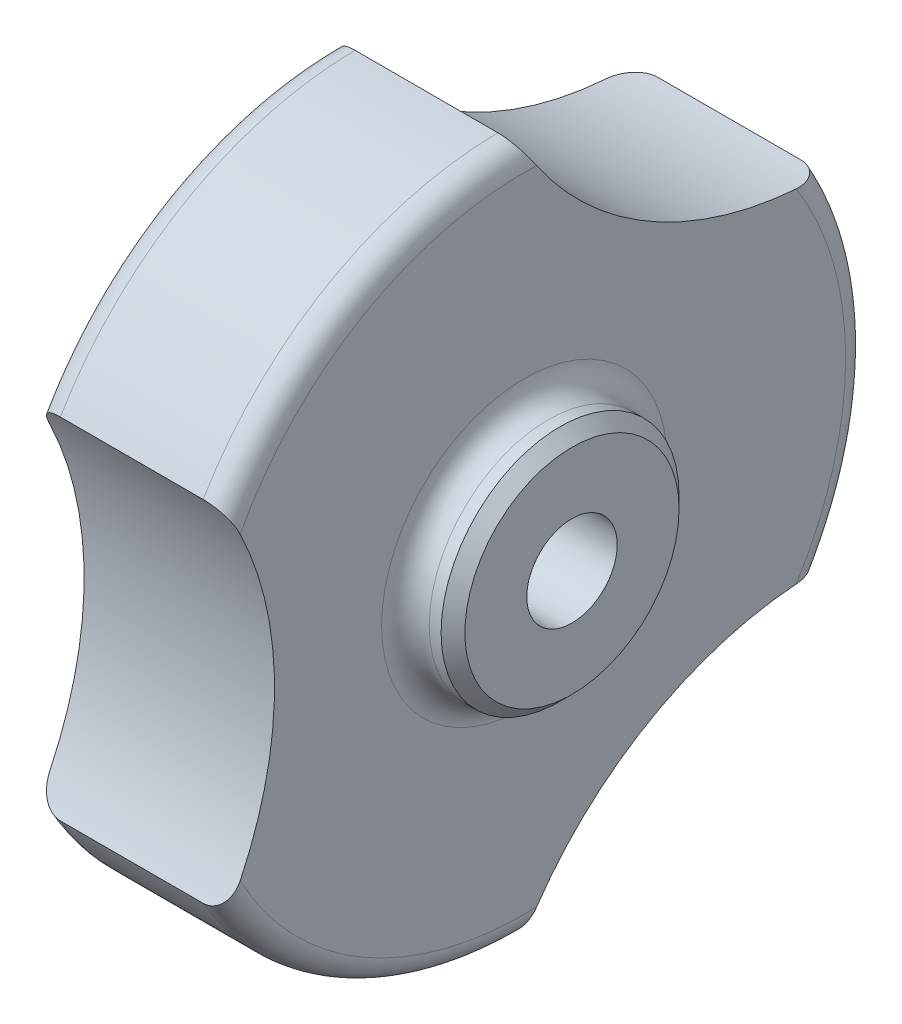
SolidWorks part; units mm, degrees
ref_plane "Plan de face" through (0, 0, 0) normal (0, 0, 1) x (1, 0, 0)
ref_plane "Plan de dessus" through (0, 0, 0) normal (0, 1, 0) x (1, 0, 0)
ref_plane "Plan de droite" through (0, 0, 0) normal (1, 0, 0) x (0, 0, -1)
sketch "Esquisse1" plane through (0, 0, 0) normal (0, 0, 1) x (1, 0, 0)
  line L0 (0, 0) -> (23.0527, 0) construction
  line L1 (0, 0) -> (0, 14.5)
  line L2 (0, 14.5) -> (8, 14.5)
  line L3 (8, 14.5) -> (8, 0)
  line L6 (0, 0) -> (8, 0)
  dimension "D3" = 8
  dimension "D4" = 29
revolve "Révolution1" add sketch "Esquisse1" angle 360 about L0
fillet "Congé1" radius 1 2 edges at (8, 0, 14.5) (0, 0, 14.5)
sketch "Esquisse2" plane through (0, 0, 0) normal (-1, 0, 0) x (0, 0, 1)
  line L0 (0, 0) -> (25, 0) construction
  circle A0 centre (25, 0) radius 14.5
  dimension "D1" = 29
  dimension "D2" = 25
extrude "Enlèv. mat.-Extru.1" cut sketch "Esquisse2" against normal through all
pattern_circular "Répétition circulaire1" count 3 over 360 about axis through (0, 0, 0) along (1, 0, 0) of "Enlèv. mat.-Extru.1"
hole_wizard "Diamètre du perçage Ø3.8 (3.8)1" positions "Esquisse4" profile "Esquisse3" hole size "Ø3.8" standard "ISO"
sketch "Esquisse4" plane through (8, 0, 0) normal (1, 0, 0) x (0, 0, -1)
  arc A0 (0.5143, 13.4902) -> (-11.94, 6.2997) centre (0, 0) ccw construction
  point P0 (0, 0)
sketch "Esquisse3" plane through (8, 0, 0) normal (0, 1, 0) x (0, 0, -1)
  line L0 (0, 0) -> (0, 7.6416)
  line L1 (0, 7.6416) -> (1.9, 6.5)
  line L2 (1.9, 6.5) -> (1.9, 0)
  line L5 (1.9, 0) -> (0, 0)
  line L10 (0, 7.6416) -> (-1.9, 6.5) construction
  line L11 (0, -6.35) -> (0, 107.95) construction
  dimension "Diamètre du perçage" = 3.8
  dimension "Profondeur du perçage" = 6.5
  dimension "Angle de pointe" = 118
sketch "Esquisse5" plane through (8, 0, 0) normal (1, 0, 0) x (0, 0, -1)
  circle A0 centre (0, 0) radius 5
  circle A1 centre (0, 0) radius 1.9
  circle A2 centre (0, 0) radius 1.9 construction
  dimension "D1" = 10
extrude "Boss.-Extru.1" add sketch "Esquisse5" along normal blind 2
fillet "Congé2" radius 1 1 edges at (8, 0, 5)
chamfer "Chanfrein1" distance 0.5 angle 45 1 edges at (10, 0, -5)
